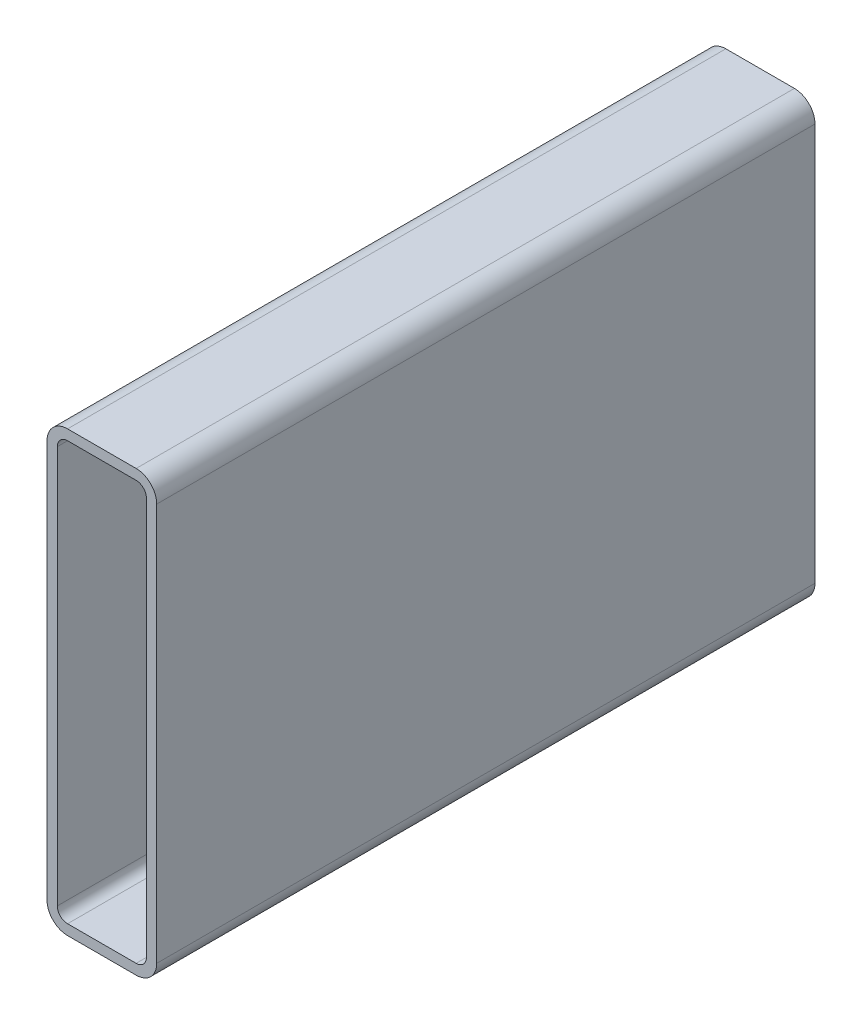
SolidWorks part; units mm, degrees
ref_plane "Front Plane" through (0, 0, 0) normal (0, 0, 1) x (1, 0, 0)
ref_plane "Top Plane" through (0, 0, 0) normal (0, 1, 0) x (1, 0, 0)
ref_plane "Right Plane" through (0, 0, 0) normal (1, 0, 0) x (0, 0, -1)
sketch "Sketch1" plane through (0, 0, 0) normal (0, 0, 1) x (1, 0, 0)
  line B0 (9.525, 203.2) -> (41.275, 203.2)
  arc B1 (50.8, 193.675) -> (41.275, 203.2) centre (41.275, 193.675) ccw
  line B2 (50.8, 193.675) -> (50.8, 9.525)
  arc B3 (41.275, 0) -> (50.8, 9.525) centre (41.275, 9.525) ccw
  line B4 (41.275, 0) -> (9.525, 0)
  arc B5 (0, 9.525) -> (9.525, 0) centre (9.525, 9.525) ccw
  line B6 (0, 9.525) -> (0, 193.675)
  arc B7 (9.525, 203.2) -> (0, 193.675) centre (9.525, 193.675) ccw
  line B8 (9.525, 198.4375) -> (41.275, 198.4375)
  arc B9 (46.0375, 193.675) -> (41.275, 198.4375) centre (41.275, 193.675) ccw
  line B10 (46.0375, 193.675) -> (46.0375, 9.525)
  arc B11 (41.275, 4.7625) -> (46.0375, 9.525) centre (41.275, 9.525) ccw
  line B12 (41.275, 4.7625) -> (9.525, 4.7625)
  arc B13 (4.7625, 9.525) -> (9.525, 4.7625) centre (9.525, 9.525) ccw
  line B14 (4.7625, 9.525) -> (4.7625, 193.675)
  arc B15 (9.525, 198.4375) -> (4.7625, 193.675) centre (9.525, 193.675) ccw
sketch_block_instance "HSS8x2x0.1875-1"
sketch_block "HSS8x2x0.1875"
extrude "Boss-Extrude1" add sketch "Sketch1" along normal blind 304.8
